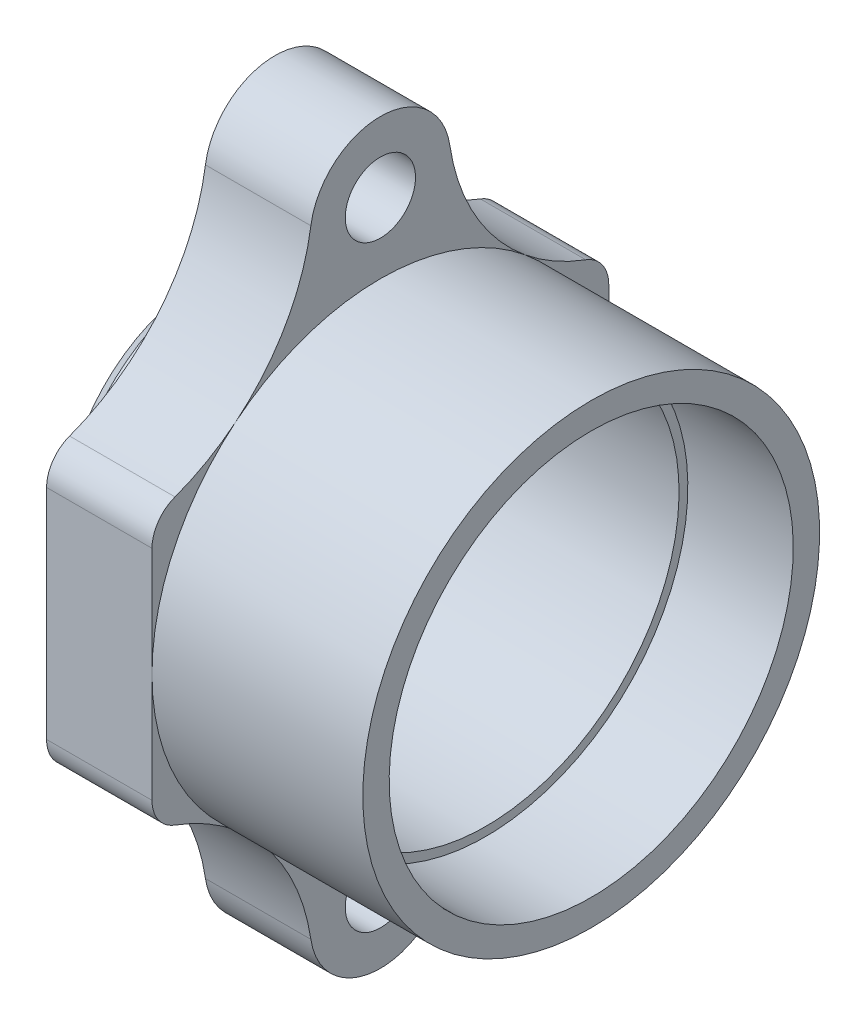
SolidWorks part; units mm, degrees
ref_plane "Face" through (0, 0, 0) normal (0, 0, 1) x (1, 0, 0)
ref_plane "Dessus" through (0, 0, 0) normal (0, 1, 0) x (1, 0, 0)
ref_plane "Droite" through (0, 0, 0) normal (1, 0, 0) x (0, 0, -1)
sketch "Esquisse1" plane through (0, 0, 0) normal (0, 0, 1) x (1, 0, 0)
  line L0 (5.7, 3.5) -> (2.7, 3.5)
  line L1 (2.7, 3.5) -> (2.7, 3.25)
  line L2 (2.1, 3.25) -> (0.5, 3.25)
  line L3 (2.7, 3.25) -> (-2.3, 3.25)
  line L4 (-1.5, 0.75) -> (-5.3, 0.75) construction
  line L10 (-2.3, 2.75) -> (-2.3, -7.25) construction
  line L11 (-2.3, 3.25) -> (-2.3, 0.75)
  line L12 (5.7, 4.25) -> (-3.3, 4.25)
  line L13 (5.7, 4.25) -> (5.7, 3.5)
  line L14 (-3.3, 2.25) -> (-5.3, 2.25)
  line L15 (-3.3, 4.25) -> (-3.3, 2.25)
  line L16 (8.3136, -2.25) -> (-8.1006, -2.25) construction
  line L17 (11.299, -2.25) -> (1.299, -2.25) construction
  line L21 (-2.3, 0.75) -> (-5.3, 0.75)
  line L41 (-5.3, 0.25) -> (-5.3, -4.75)
  line L42 (-5.3, 2.25) -> (-5.3, 0.75)
  dimension "D3" = 1
  dimension "D6" = 8
  dimension "D7" = 5.75
  dimension "D4" = 1
  dimension "D8" = 3
  dimension "D5" = 9
  dimension "D1" = 0.5
  dimension "D2" = 0.5
revolve "Base-Révolution" add sketch "Esquisse1" angle 360 about L16
chamfer "Chanfrein1" distance 0.5 angle 45
sketch "Esquisse2" plane through (-3.3, 0, 0) normal (-1, 0, 0) x (0, 0, 1)
  line L0 (0, 5.7981) -> (0, -12.9295) construction
  line L1 (-6.5, 0.8555) -> (-6.5, -5.3555)
  line L2 (6.5, 0.8555) -> (6.5, -5.3555)
  line L4 (0, -2.25) -> (8.1692, -2.25) construction
  circle A0 centre (0, -10.75) radius 1
  arc A1 (-1.9783, -11.0441) -> (1.9783, -11.0441) centre (0, -10.75) ccw
  arc A2 (5.8447, -6.2942) -> (1.9783, -11.0441) centre (7.913, -11.9265) ccw
  circle A3 centre (0, -2.25) radius 6.5 construction
  arc A4 (6.5, -5.3555) -> (5.8447, -6.2942) centre (5.5, -5.3555) cw
  arc A5 (-6.5, -5.3555) -> (-5.8447, -6.2942) centre (-5.5, -5.3555) ccw
  arc A6 (-5.8447, -6.2942) -> (-1.9783, -11.0441) centre (-7.913, -11.9265) cw
  arc A7 (-6.5, 0.8555) -> (-5.8447, 1.7942) centre (-5.5, 0.8555) cw
  arc A8 (-5.8447, 1.7942) -> (-1.9783, 6.5441) centre (-7.913, 7.4265) ccw
  circle A9 centre (0, 6.25) radius 1
  arc A10 (-1.9783, 6.5441) -> (1.9783, 6.5441) centre (0, 6.25) cw
  arc A11 (5.8447, 1.7942) -> (1.9783, 6.5441) centre (7.913, 7.4265) cw
  arc A12 (6.5, 0.8555) -> (5.8447, 1.7942) centre (5.5, 0.8555) ccw
  circle A13 centre (0, -2.25) radius 5.5 construction
  circle A14 centre (0, -2.25) radius 5.5
  point P9 (-6.5, -2.25)
  point P22 (6.5, -2.2671)
  point P33 (-6.5, -2.2671)
  point P35 (6.5, -2.25)
  dimension "D1" = 2
  dimension "D3" = 4
  dimension "D4" = 12
  dimension "D5" = 1
  dimension "D2" = 8.5
extrude "Boss.-Extru.1" add sketch "Esquisse2" against normal blind 3
